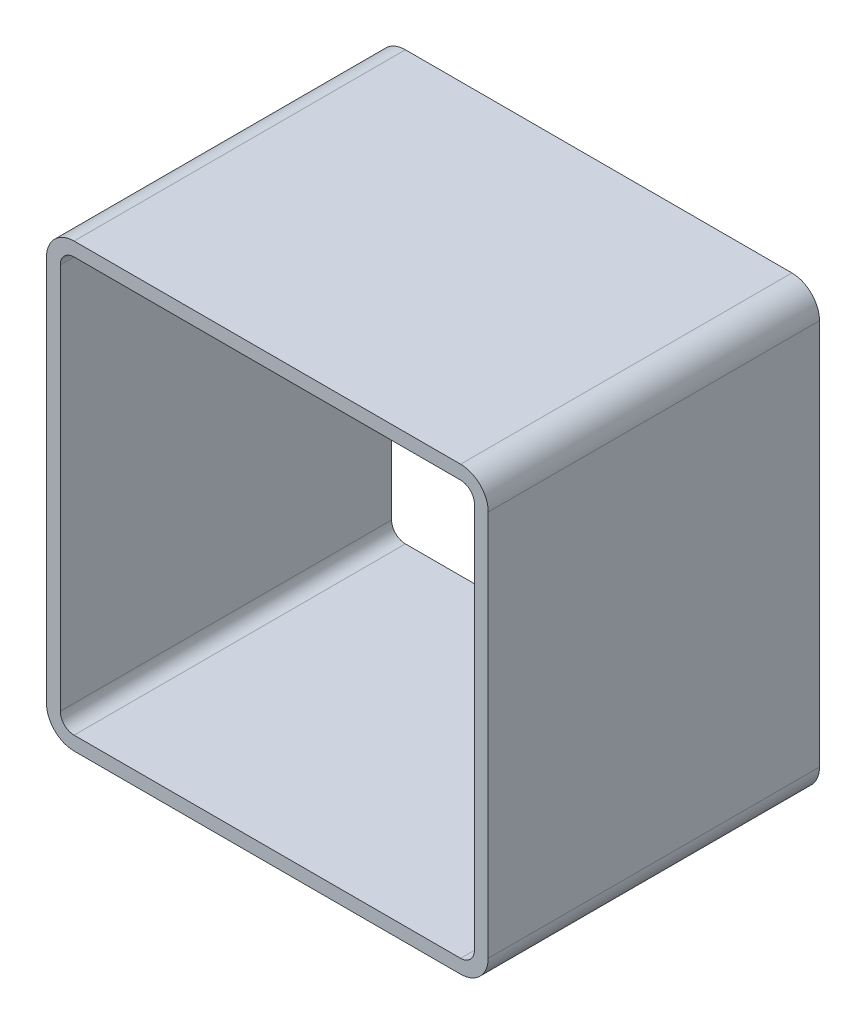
SolidWorks part; units mm, degrees
ref_plane "Front Plane" through (0, 0, 0) normal (0, 0, 1) x (1, 0, 0)
ref_plane "Top Plane" through (0, 0, 0) normal (0, 1, 0) x (1, 0, 0)
ref_plane "Right Plane" through (0, 0, 0) normal (1, 0, 0) x (0, 0, -1)
sketch "Sketch1" plane through (0, 0, 0) normal (0, 0, 1) x (1, 0, 0)
sketch_block_instance "HSS16x16x0.500-1"
sketch_block "HSS16x16x0.500"
extrude "Boss-Extrude1" add sketch "Sketch1" along normal blind 304.8
